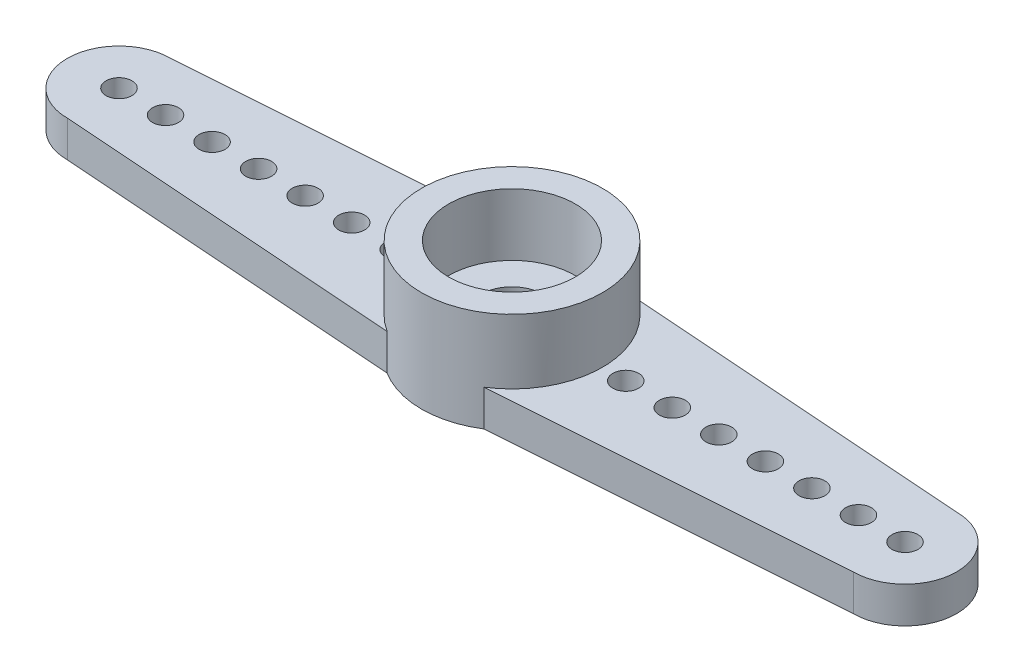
SolidWorks part; units mm, degrees
other "Camera1"
ref_plane "Front Plane" through (0, 0, 0) normal (0, 0, 1) x (1, 0, 0)
ref_plane "Top Plane" through (0, 0, 0) normal (0, 1, 0) x (1, 0, 0)
ref_plane "Right Plane" through (0, 0, 0) normal (1, 0, 0) x (0, 0, -1)
sketch "Sketch1" plane through (0, 0, 0) normal (0, 1, 0) x (1, 0, 0)
  line L0 (-17.2, 0) -> (17.2, 0) construction
  line L1 (0, -8.35) -> (0, 8.35) construction
  line L2 (-15.2, 2) -> (-2, 2.95)
  line L3 (-15.2, -2) -> (-2, -2.95)
  line L4 (2, 6.35) -> (2, 3.5)
  line L5 (-2, 6.35) -> (-2, 2.95)
  line L6 (2, -6.35) -> (2, -3.5)
  line L7 (-2, -6.35) -> (-2, -2.95)
  line L8 (15.2, 2) -> (2, 3.5)
  line L9 (15.2, -2) -> (2, -3.5)
  circle A0 centre (0, 0) radius 3.5 construction
  arc A1 (-15.2, 2) -> (-15.2, -2) centre (-15.2, 0) ccw
  arc A2 (15.2, 2) -> (15.2, -2) centre (15.2, 0) cw
  arc A3 (2, 6.35) -> (-2, 6.35) centre (0, 6.35) ccw
  circle A4 centre (0, 6.35) radius 0.5
  circle A5 centre (0, 4.55) radius 0.5
  circle A6 centre (0, -4.55) radius 0.5
  circle A7 centre (0, -6.35) radius 0.5
  arc A8 (2, -6.35) -> (-2, -6.35) centre (0, -6.35) cw
  circle A10 centre (-15.2, 0) radius 0.5
  circle A11 centre (15.2, 0) radius 0.5
  circle A12 centre (-13.4, 0) radius 0.5
  circle A13 centre (-11.6, 0) radius 0.5
  circle A14 centre (-9.8, 0) radius 0.5
  circle A15 centre (-8, 0) radius 0.5
  circle A16 centre (-6.2, 0) radius 0.5
  circle A17 centre (-4.4, 0) radius 0.5
  circle A18 centre (13.4, 0) radius 0.5
  circle A19 centre (11.6, 0) radius 0.5
  circle A20 centre (9.8, 0) radius 0.5
  circle A21 centre (8, 0) radius 0.5
  circle A22 centre (6.2, 0) radius 0.5
  circle A23 centre (4.4, 0) radius 0.5
  arc A24 (-5.504, -2.8541) -> (-5.5083, 2.8459) centre (0, 0) ccw construction
  arc A25 (-5.4121, -2.7041) -> (-5.4161, 2.6959) centre (0, 0) ccw construction
  point P5 (0, 0)
  point P8 (0, 0)
  point P25 (0, 6.85)
  point P26 (0, 4.05)
  dimension "D1" = 7
  dimension "D4" = 4
  dimension "D6" = 1
  dimension "D2" = 34.4
  dimension "D3" = 16.7
  dimension "D5" = 2
  dimension "D7" = 2.8
  dimension "D8" = 7
  dimension "D10" = 5.9
  dimension "D11" = 7
  dimension "D12" = 7
extrude "Boss-Extrude1" add sketch "Sketch1" along normal blind 1.4
sketch "Sketch2" plane through (0, 0, 0) normal (0, -1, 0) x (1, 0, 0)
  circle A0 centre (0, 0) radius 2.35
  dimension "D1" = 4.7
extrude "Cut-Extrude1" cut sketch "Sketch2" against normal blind 1
sketch "Sketch3" plane through (0, 1.4, 0) normal (0, 1, 0) x (1, 0, 0)
  circle A0 centre (0, 0) radius 2.45
  circle A1 centre (0, 0) radius 3.5
  dimension "D1" = 4.9
  dimension "D2" = 7
extrude "Boss-Extrude2" add sketch "Sketch3" along normal blind 2.5
sketch "Sketch4" plane through (0, 1.4, 0) normal (0, 1, 0) x (1, 0, 0)
  circle A0 centre (0, 0) radius 1.2
  dimension "D1" = 2.4
extrude "Cut-Extrude2" cut sketch "Sketch4" against normal through all
sketch "Sketch5" plane through (0, 1.4, 0) normal (0, 1, 0) x (1, 0, 0)
  circle A0 centre (0, 0) radius 1.2 construction
  circle A1 centre (0, 0) radius 2.45
  circle A2 centre (0, 0) radius 2.45
  circle A3 centre (0, 0) radius 1.2
  dimension "D1" = 0
extrude "Boss-Extrude3" add sketch "Sketch5" along normal blind 0.1
sketch "Sketch6" plane through (0, 0, 0) normal (0, -1, 0) x (1, 0, 0)
  line L0 (-2, -2.95) -> (-15.2, -2) construction
  line L1 (-1.8686, -2.9595) -> (-15.2, -2)
  line L2 (-15.2, 2) -> (-2, 2.95) construction
  line L3 (-15.2, 2) -> (-1.8686, 2.9595)
  line L4 (0, -9.3016) -> (0, 8.6978) construction
  line L5 (1.8686, -2.9595) -> (15.2, -2)
  line L6 (15.2, 2) -> (1.8686, 2.9595)
  line L8 (-17.8676, -8.836) -> (17.8676, -8.836)
  line L9 (-17.8676, -8.836) -> (-17.8676, 8.836)
  line L10 (-17.8676, 8.836) -> (17.8676, 8.836)
  line L11 (17.8676, -8.836) -> (17.8676, 8.836)
  line L12 (-17.8676, -8.836) -> (17.8676, 8.836) construction
  line L13 (-17.8676, 8.836) -> (17.8676, -8.836) construction
  arc A0 (-15.2, 2) -> (-15.2, -2) centre (-15.2, 0) ccw construction
  arc A1 (-15.2, 2) -> (-15.2, -2) centre (-15.2, 0) ccw
  circle A2 centre (0, 0) radius 3.5 construction
  arc A3 (1.8686, 2.9595) -> (-1.8686, 2.9595) centre (0, 0) ccw
  arc A4 (15.2, 2) -> (15.2, -2) centre (15.2, 0) cw
  arc A5 (-1.8686, -2.9595) -> (1.8686, -2.9595) centre (0, 0) ccw
extrude "Cut-Extrude4" cut sketch "Sketch6" against normal through all
sketch "Sketch7" [suppressed] plane through (0, 0, 0) normal (0, -1, 0) x (1, 0, 0)
  line L0 (0, 3.5) -> (-17.7318, 3.5)
  line L1 (-17.7318, 3.5) -> (-17.7318, -3.5)
  line L2 (-17.7318, -3.5) -> (0, -3.5)
  circle A0 centre (0, 0) radius 3.5 construction
  arc A1 (0, 3.5) -> (0, -3.5) centre (0, 0) ccw
extrude "Cut-Extrude5" [suppressed] cut sketch "Sketch7" against normal through all
sketch "Esquisse1" plane through (0, 0, 0) normal (0, -1, 0) x (1, 0, 0)
  line L0 (15.2, -2) -> (1.8686, -2.9595)
  line L2 (1.8686, 2.9595) -> (15.2, 2)
  circle A0 centre (0, 0) radius 3.5
  arc A2 (15.2, -2) -> (15.2, 2) centre (15.2, 0) ccw
  arc A3 (1.8686, -2.9595) -> (1.8686, 2.9595) centre (0, 0) ccw
extrude "Enlèv. mat.-Extru.1" [suppressed] cut sketch "Esquisse1" against normal blind 3 contours A0 M24 M25 M26 M6 M14 M16 M18 M17 M15 M13
